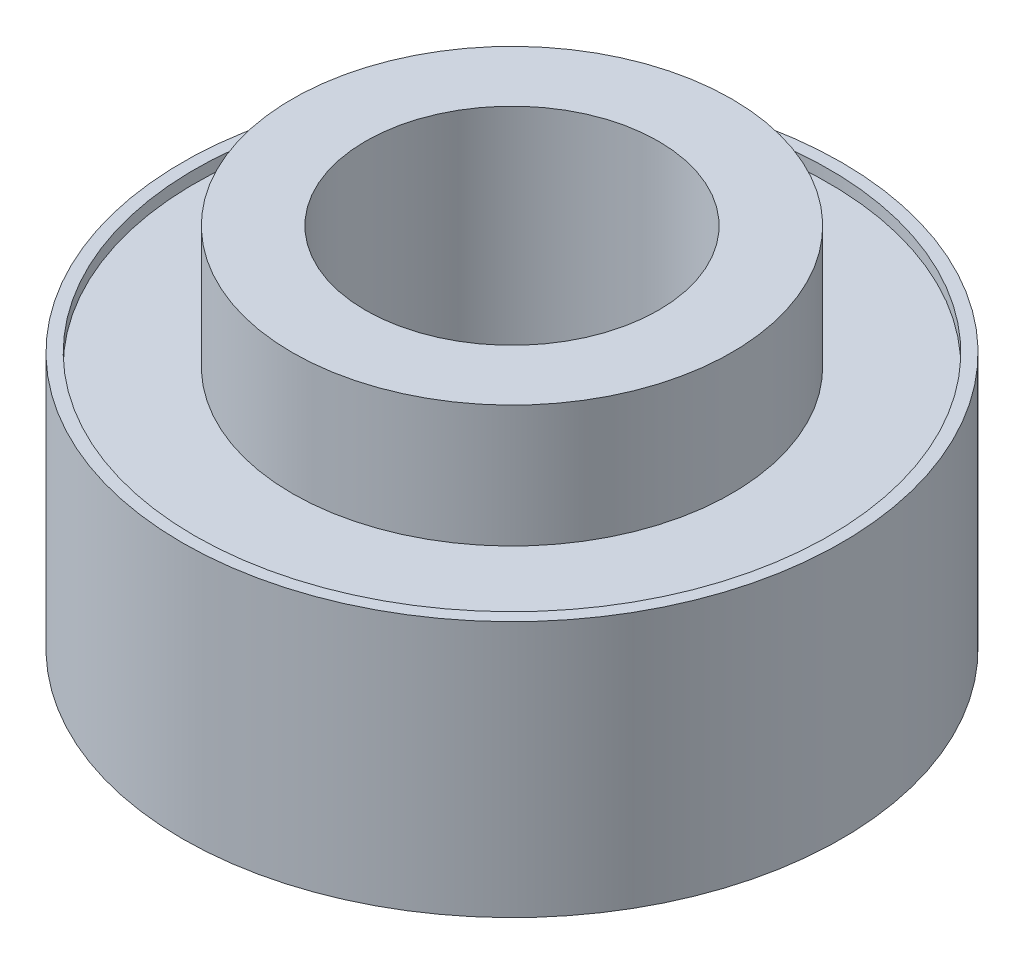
SolidWorks part; units mm, degrees
ref_plane "Спереди" through (0, 0, 0) normal (0, 0, 1) x (1, 0, 0)
ref_plane "Сверху" through (0, 0, 0) normal (0, 1, 0) x (1, 0, 0)
ref_plane "Справа" through (0, 0, 0) normal (1, 0, 0) x (0, 0, -1)
sketch "Эскиз1" plane through (0, 0, 0) normal (0, 1, 0) x (1, 0, 0)
  circle A0 centre (0, 0) radius 13.5
  dimension "D1" = 27
extrude "Бобышка-Вытянуть1" add sketch "Эскиз1" along normal blind 10.5
sketch "Эскиз2" plane through (0, 10.5, 0) normal (0, 1, 0) x (1, 0, 0)
  circle A0 centre (0, 0) radius 13
  circle A1 centre (0, 0) radius 13.5 construction
  dimension "D1" = 0.5
extrude "Вырез-Вытянуть1" cut sketch "Эскиз2" against normal blind 0.5
sketch "Эскиз3" plane through (0, 0, 0) normal (0, -1, 0) x (1, 0, 0)
  circle A0 centre (0, 0) radius 13
  circle A1 centre (0, 0) radius 13.5 construction
  dimension "D1" = 0.5
extrude "Вырез-Вытянуть2" cut sketch "Эскиз3" against normal blind 0.5
sketch "Эскиз4" plane through (0, 10, 0) normal (0, 1, 0) x (1, 0, 0)
  circle A0 centre (0, 0) radius 6
  dimension "D1" = 12
extrude "Вырез-Вытянуть3" cut sketch "Эскиз4" against normal through all
sketch "Эскиз5" plane through (0, 10, 0) normal (0, 1, 0) x (1, 0, 0)
  circle A0 centre (0, 0) radius 9
  circle A1 centre (0, 0) radius 6 construction
  circle A2 centre (0, 0) radius 6
  dimension "D1" = 3
extrude "Бобышка-Вытянуть2" add sketch "Эскиз5" along normal blind 5
sketch "Эскиз6" plane through (0, 0.5, 0) normal (0, -1, 0) x (1, 0, 0)
  circle A0 centre (0, 0) radius 6 construction
  circle A1 centre (0, 0) radius 9
  circle A2 centre (0, 0) radius 9
  circle A3 centre (0, 0) radius 6
  dimension "D1" = 0
extrude "Бобышка-Вытянуть3" add sketch "Эскиз6" along normal blind 1.5
